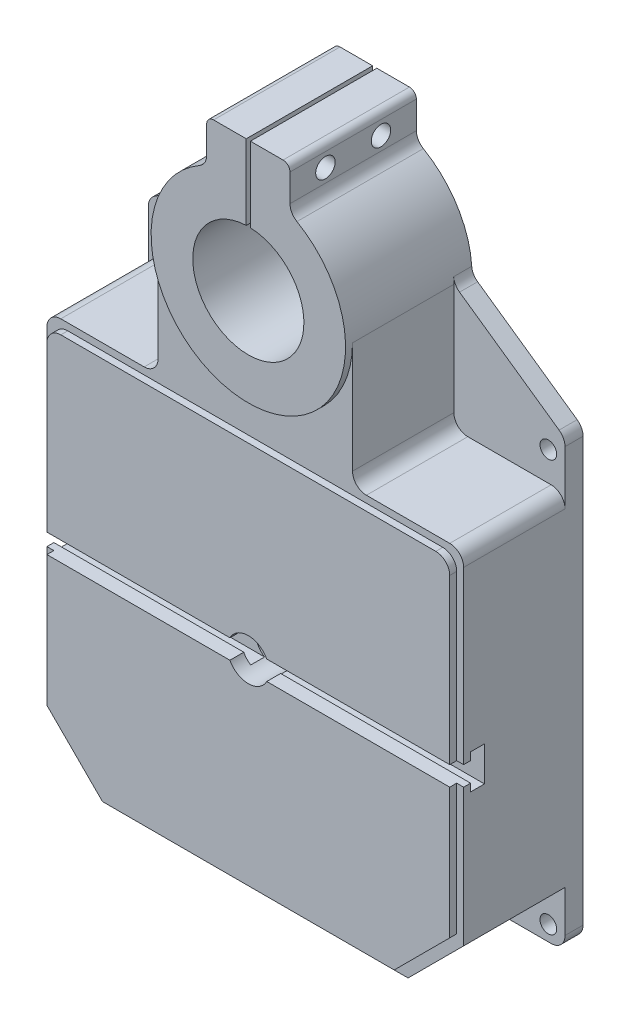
SolidWorks part; units mm, degrees
ref_plane "前视基准面" through (0, 0, 0) normal (0, 0, 1) x (1, 0, 0)
ref_plane "上视基准面" through (0, 0, 0) normal (0, 1, 0) x (1, 0, 0)
ref_plane "右视基准面" through (0, 0, 0) normal (1, 0, 0) x (0, 0, -1)
sketch "草图1" plane through (0, 0, 0) normal (0, 0, 1) x (1, 0, 0)
  line L0 (0, 0) -> (0, 230) construction
  line L1 (0, 0) -> (150, 0) construction
  line L2 (150, 168.7943) -> (150, -136)
  line L3 (140, -146) -> (-140, -146)
  line L4 (-150, -136) -> (-150, 168.7943)
  line L5 (0, 230) -> (0, 324) construction
  line L6 (0, 0) -> (-138, 0) construction
  line L7 (-138, 0) -> (-138, -135) construction
  line L8 (-138, 0) -> (-138, 161) construction
  line L9 (-145.7358, 176.9858) -> (-74.0853, 227.156)
  line L10 (145.7358, 176.9858) -> (74.0853, 227.156)
  line L11 (0, 324) -> (25, 324)
  line L12 (0, 324) -> (-25, 324)
  line L13 (-30, 319) -> (-30, 299.282)
  line L14 (30, 319) -> (30, 299.282)
  circle A0 centre (0, 0) radius 15
  circle A1 centre (0, 230) radius 40
  circle A2 centre (-138, -135) radius 6
  circle A3 centre (-138, 161) radius 6
  circle A4 centre (138, -135) radius 6
  circle A5 centre (138, 161) radius 6
  arc A6 (-35, 290.6218) -> (-69.8434, 234.6791) centre (0, 230) ccw
  arc A7 (69.8434, 234.6791) -> (35, 290.6218) centre (0, 230) ccw
  arc A8 (30, 299.282) -> (35, 290.6218) centre (40, 299.282) ccw
  arc A9 (74.0853, 227.156) -> (69.8434, 234.6791) centre (79.8211, 235.3476) cw
  arc A10 (-30, 299.282) -> (-35, 290.6218) centre (-40, 299.282) cw
  arc A11 (-69.8434, 234.6791) -> (-74.0853, 227.156) centre (-79.8211, 235.3476) cw
  arc A12 (-145.7358, 176.9858) -> (-150, 168.7943) centre (-140, 168.7943) ccw
  arc A13 (145.7358, 176.9858) -> (150, 168.7943) centre (140, 168.7943) cw
  arc A14 (150, -136) -> (140, -146) centre (140, -136) cw
  arc A15 (-150, -136) -> (-140, -146) centre (-140, -136) ccw
  arc A16 (25, 324) -> (30, 319) centre (25, 319) cw
  arc A17 (-30, 319) -> (-25, 324) centre (-25, 319) cw
  point P36 (-150, 174)
  dimension "D1" = 10
  dimension "D2" = 5
extrude "凸台-拉伸1" add sketch "草图1" along normal blind 13
sketch "草图2" plane through (0, 0, 13) normal (0, 0, 1) x (1, 0, 0)
  line L0 (-140, -146) -> (140, -146) construction
  line L1 (150, -136) -> (150, 168.7943) construction
  line L2 (-150, 168.7943) -> (-150, -136) construction
  line L3 (-110, -146) -> (110, -146)
  line L4 (150, -106) -> (150, 130)
  line L5 (-150, 130) -> (-150, -106)
  line L6 (-150, -106) -> (-110, -146)
  line L7 (110, -146) -> (150, -106)
  line L8 (0, 0) -> (0, 140) construction
  line L9 (-140, 140) -> (-80, 140)
  line L10 (30, 299.282) -> (30, 319) construction
  line L11 (-30, 319) -> (-30, 299.282) construction
  line L12 (25, 324) -> (-25, 324) construction
  line L13 (30, 299.282) -> (30, 319)
  line L14 (-30, 319) -> (-30, 299.282)
  line L15 (25, 324) -> (-25, 324)
  line L16 (70, 230) -> (70, 150)
  line L17 (-70, 230) -> (-70, 150)
  line L18 (80, 140) -> (140, 140)
  circle A0 centre (0, 0) radius 15 construction
  circle A1 centre (0, 230) radius 40 construction
  circle A2 centre (0, 0) radius 15
  circle A3 centre (0, 230) radius 40
  arc A4 (140, 140) -> (150, 130) centre (140, 130) cw
  arc A5 (-140, 140) -> (-150, 130) centre (-140, 130) ccw
  arc A6 (30, 299.282) -> (35, 290.6218) centre (40, 299.282) ccw construction
  arc A7 (30, 319) -> (25, 324) centre (25, 319) ccw construction
  arc A8 (-35, 290.6218) -> (-30, 299.282) centre (-40, 299.282) ccw construction
  arc A9 (-25, 324) -> (-30, 319) centre (-25, 319) ccw construction
  arc A10 (30, 299.282) -> (35, 290.6218) centre (40, 299.282) ccw
  arc A11 (30, 319) -> (25, 324) centre (25, 319) ccw
  arc A12 (-35, 290.6218) -> (-30, 299.282) centre (-40, 299.282) ccw
  arc A13 (-25, 324) -> (-30, 319) centre (-25, 319) ccw
  arc A14 (70, 230) -> (35, 290.6218) centre (0, 230) ccw
  arc A15 (70, 150) -> (80, 140) centre (80, 150) ccw
  arc A16 (-70, 150) -> (-80, 140) centre (-80, 150) cw
  arc A17 (-35, 290.6218) -> (-70, 230) centre (0, 230) ccw
  point P14 (-150, -146)
  point P17 (150, -146)
  dimension "D1" = 10
  dimension "D2" = 10
extrude "凸台-拉伸2" add sketch "草图2" along normal blind 73
sketch "草图3" plane through (0, 0, 86) normal (0, 0, 1) x (1, 0, 0)
  line L0 (0, 0) -> (145, 0) construction
  line L1 (145, 125) -> (145, -101)
  line L2 (105, -141) -> (-105, -141)
  line L3 (-145, -101) -> (-145, 125)
  line L4 (-135, 135) -> (135, 135)
  line L5 (-105, -141) -> (-145, -101)
  line L6 (145, -101) -> (105, -141)
  line L7 (30, 299.282) -> (30, 319) construction
  line L8 (-30, 319) -> (-30, 299.282) construction
  line L9 (25, 324) -> (-25, 324) construction
  line L10 (30, 299.282) -> (30, 319)
  line L11 (-30, 319) -> (-30, 299.282)
  line L12 (25, 324) -> (-25, 324)
  arc A0 (135, 135) -> (145, 125) centre (135, 125) cw
  arc A1 (-135, 135) -> (-145, 125) centre (-135, 125) ccw
  arc A2 (30, 299.282) -> (35, 290.6218) centre (40, 299.282) ccw construction
  arc A3 (30, 319) -> (25, 324) centre (25, 319) ccw construction
  arc A4 (-35, 290.6218) -> (-30, 299.282) centre (-40, 299.282) ccw construction
  arc A5 (-25, 324) -> (-30, 319) centre (-25, 319) ccw construction
  circle A6 centre (0, 230) radius 40 construction
  circle A7 centre (0, 0) radius 15 construction
  arc A8 (30, 299.282) -> (35, 290.6218) centre (40, 299.282) ccw
  arc A9 (30, 319) -> (25, 324) centre (25, 319) ccw
  arc A10 (-35, 290.6218) -> (-30, 299.282) centre (-40, 299.282) ccw
  arc A11 (-25, 324) -> (-30, 319) centre (-25, 319) ccw
  circle A12 centre (0, 230) radius 40
  circle A13 centre (0, 0) radius 15
  arc A14 (-35, 290.6218) -> (35, 290.6218) centre (0, 230) ccw
  point P4 (145, -141)
  point P5 (-145, -141)
  dimension "D1" = 10
extrude "凸台-拉伸3" add sketch "草图3" along normal blind 5
sketch "草图4" plane through (0, 0, 0) normal (0, 0, -1) x (-1, 0, 0)
  line L0 (0, 0) -> (137, 0) construction
  line L1 (137, 127) -> (137, -83)
  line L2 (97, -123) -> (-97, -123)
  line L3 (-137, -83) -> (-137, 127)
  line L4 (-127, 137) -> (-69, 137)
  line L5 (-97, -123) -> (-137, -83)
  line L6 (137, -83) -> (97, -123)
  line L7 (0, 137) -> (0, 182) construction
  line L8 (0, 182) -> (49, 182)
  line L9 (0, 182) -> (-49, 182)
  line L10 (-59, 172) -> (-59, 147)
  line L11 (59, 172) -> (59, 147)
  line L12 (69, 137) -> (127, 137)
  arc A0 (127, 137) -> (137, 127) centre (127, 127) cw
  arc A1 (-137, 127) -> (-127, 137) centre (-127, 127) cw
  arc A2 (59, 147) -> (69, 137) centre (69, 147) ccw
  arc A3 (49, 182) -> (59, 172) centre (49, 172) cw
  arc A4 (-49, 182) -> (-59, 172) centre (-49, 172) ccw
  arc A5 (-59, 147) -> (-69, 137) centre (-69, 147) cw
  point P4 (137, -123)
  point P5 (-137, -123)
  dimension "D1" = 10
  dimension "D2" = 10
extrude "切除-拉伸1" cut sketch "草图4" against normal blind 66
sketch "草图5" plane through (0, 0, 66) normal (0, 0, -1) x (-1, 0, 0)
  line L1 (137, 22.5) -> (-137, 22.5)
  line L2 (137, 22.5) -> (137, -22.5)
  line L3 (137, -22.5) -> (-137, -22.5)
  line L4 (-137, 22.5) -> (-137, -22.5)
  line L5 (137, 22.5) -> (-137, -22.5) construction
  line L6 (137, -22.5) -> (-137, 22.5) construction
  circle A0 centre (0, 0) radius 15 construction
  circle A1 centre (0, 0) radius 15
  point P0 (0, 0)
  dimension "D1" = 45
  dimension "D2" = 274
extrude "凸台-拉伸4" add sketch "草图5" along normal blind 15
fillet "圆角1" radius 5 4 edges at (137, 22.5, 58.5) (-137, 22.5, 58.5) (-137, -22.5, 58.5) (137, -22.5, 58.5)
sketch "草图6" plane through (-150, 0, 0) normal (-1, 0, 0) x (0, 0, 1)
  line L0 (0, 0) -> (71, 0) construction
  line L2 (71, 12.5) -> (71, -12.5)
  line L3 (71, -12.5) -> (81, -12.5)
  line L4 (81, -12.5) -> (81, -7)
  line L5 (81, -7) -> (92, -7)
  line L6 (92, -7) -> (92, 7)
  line L7 (81, 12.5) -> (81, 7)
  line L8 (81, 7) -> (92, 7)
  line L9 (71, 12.5) -> (81, 12.5)
extrude "切除-拉伸2" cut sketch "草图6" against normal blind 300
sketch "草图7" plane through (0, 324, 0) normal (0, 1, 0) x (1, 0, 0)
  line L0 (0, 0) -> (0, -91) construction
  line L1 (25, 0) -> (-25, 0) construction
  line L3 (1.5, 0.5) -> (-1.5, 0.5)
  line L4 (1.5, 0.5) -> (1.5, -91.5)
  line L5 (1.5, -91.5) -> (-1.5, -91.5)
  line L6 (-1.5, 0.5) -> (-1.5, -91.5)
  line L7 (1.5, 0.5) -> (-1.5, -91.5) construction
  line L8 (1.5, -91.5) -> (-1.5, 0.5) construction
  point P4 (0, -45.5)
  dimension "D1" = 92
  dimension "D2" = 3
extrude "切除-拉伸3" cut sketch "草图7" against normal blind 60
sketch "草图8" plane through (30, 0, 0) normal (1, 0, 0) x (0, 0, -1)
  line L0 (-91, 324) -> (0, 324) construction
  line L1 (-91, 299.282) -> (-91, 319) construction
  line L2 (0, 299.282) -> (0, 319) construction
  circle A0 centre (-65.5, 309) radius 7
  circle A1 centre (-25.5, 309) radius 7
  dimension "D1" = 15
  dimension "D2" = 15
  dimension "D3" = 25.5
  dimension "D4" = 25.5
extrude "切除-拉伸4" cut sketch "草图8" against normal blind 10
sketch "草图9" plane through (20, 0, 0) normal (1, 0, 0) x (0, 0, -1)
  circle A0 centre (-65.5, 309) radius 4.5
  circle A1 centre (-25.5, 309) radius 4.5
extrude "切除-拉伸5" cut sketch "草图9" against normal up to surface (50 mm away)
sketch "草图10" plane through (-150, 0, 0) normal (-1, 0, 0) x (0, 0, 1)
  line L0 (0, 168.7943) -> (0, -136) construction
  line L1 (86, 140) -> (13, 140) construction
  circle A0 centre (35, 100) radius 11
  dimension "D1" = 35
  dimension "D2" = 40
extrude "切除-拉伸6" cut sketch "草图10" against normal blind 13
sketch "草图11" plane through (0, -146, 0) normal (0, -1, 0) x (1, 0, 0)
  line L0 (-140, 0) -> (140, 0) construction
  circle A0 centre (32, 49.5) radius 10
  circle A1 centre (47, 49.5) radius 2.5
  circle A2 centre (-47, 49.5) radius 2.5
  point P8 (0, 0)
  dimension "D1" = 49.5
  dimension "D3" = 49.5
  dimension "D2" = 49.5
  dimension "D4" = 32
  dimension "D5" = 47
  dimension "D6" = 94
extrude "切除-拉伸8" cut sketch "草图11" against normal blind 15
sketch "草图12" plane through (0, 0, 0) normal (0, 0, -1) x (-1, 0, 0)
  line L0 (-137, -83) -> (-137, -93)
  line L1 (137, -83) -> (137, -93)
  line L2 (0, -146) -> (0, -133) construction
  line L3 (140, -146) -> (-140, -146) construction
  line L4 (-97, -133) -> (97, -133)
  line L5 (-137, -93) -> (-97, -133)
  line L6 (97, -133) -> (137, -93)
  line L7 (-137, -83) -> (137, -83)
  point P14 (-137, -133)
  point P16 (137, -133)
extrude "切除-拉伸10" cut sketch "草图12" against normal blind 66 contours L4 L6 L1 L0 L5 M7 M8 M9
